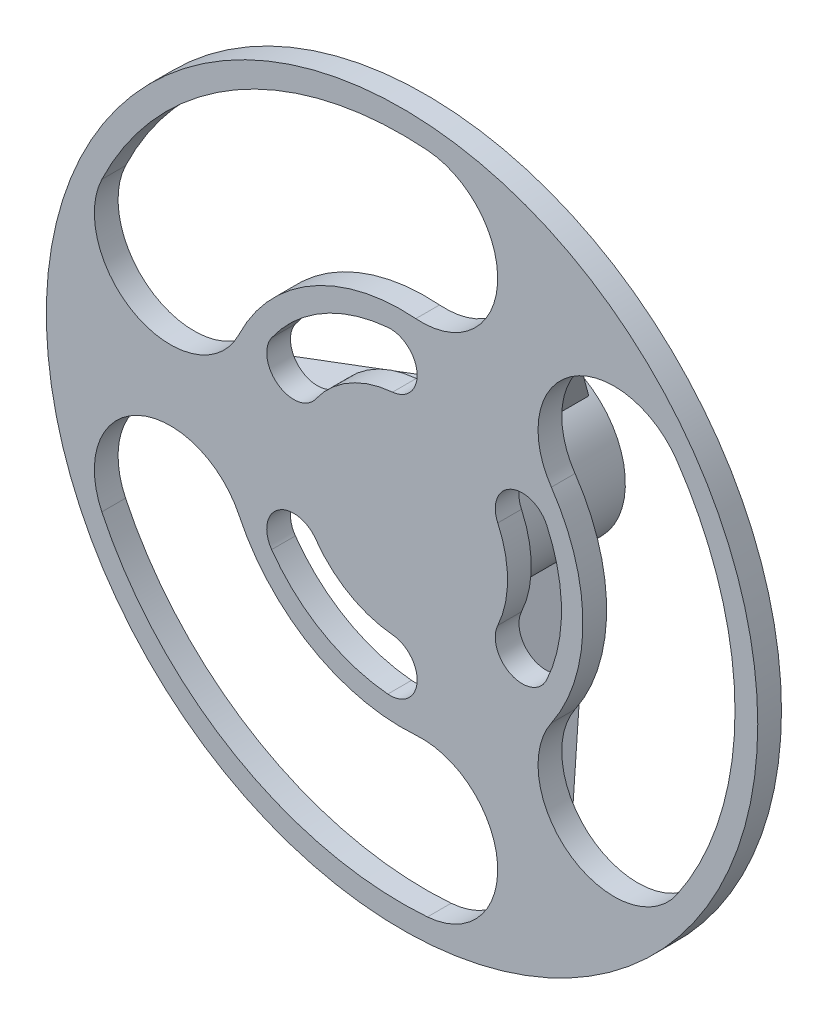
SolidWorks part; units mm, degrees
ref_plane "Plan de face" through (0, 0, 0) normal (0, 0, 1) x (1, 0, 0)
ref_plane "Plan de dessus" through (0, 0, 0) normal (0, 1, 0) x (1, 0, 0)
ref_plane "Plan de droite" through (0, 0, 0) normal (1, 0, 0) x (0, 0, -1)
sketch "Esquisse1" plane through (0, 0, 0) normal (0, 0, 1) x (1, 0, 0)
  circle A0 centre (0, 0) radius 45
  dimension "D1" = 90
extrude "Boss.-Extru.1" add sketch "Esquisse1" along normal blind 3
sketch "Esquisse2" plane through (0, 0, 0) normal (0, 0, -1) x (-1, 0, 0)
  circle A0 centre (0, 0) radius 7.25
  circle A1 centre (0, 0) radius 10.25
  dimension "D1" = 14.5
  dimension "D2" = 3
extrude "Boss.-Extru.2" add sketch "Esquisse2" along normal blind 15
sketch "Esquisse3" plane through (0, 0, 0) normal (0, 1, 0) x (1, 0, 0)
  line L0 (-8.8913, 15) -> (-33.9707, 0)
  line L1 (10.25, 15) -> (-10.25, 15) construction
  line L2 (45, 0) -> (-45, 0) construction
  line L3 (-33.9707, 0) -> (-8.8913, 0)
  line L4 (10.25, 0) -> (-10.25, 0) construction
  line L5 (-8.8913, 0) -> (-8.8913, 15)
extrude "Boss.-Extru.3" add sketch "Esquisse3" along normal mid plane 3
pattern_circular "Répétition circulaire1" count 3 over 360 about axis through (0, 0, 0) along (0, 0, 1) of "Boss.-Extru.3"
sketch "Esquisse4" plane through (0, 0, 0) normal (0, 0, -1) x (-1, 0, 0)
  line L0 (0, 0) -> (-16.9853, -29.4195) construction
  line L1 (-15.6863, -30.1695) -> (-18.2844, -28.6695) construction
  circle A0 centre (0, 0) radius 32.5 construction
  arc A1 (-2.4794, 32.4053) -> (29.3035, 14.0555) centre (0, 0) cw construction
  arc A2 (37.9768, 18.2156) -> (-3.2132, 41.9967) centre (0, 0) ccw
  arc A3 (20.6302, 9.8953) -> (-1.7455, 22.8139) centre (0, 0) ccw
  arc A4 (20.6302, 9.8953) -> (37.9768, 18.2156) centre (29.3035, 14.0555) ccw
  arc A5 (-3.2132, 41.9967) -> (-1.7455, 22.8139) centre (-2.4794, 32.4053) ccw
  circle A6 centre (0, 0) radius 16.7584 construction
  arc A7 (1.4985, 16.6912) -> (13.7058, 9.6434) centre (0, 0) cw construction
  arc A8 (16.4947, 11.6056) -> (1.8034, 20.0876) centre (0, 0) ccw
  arc A9 (10.9169, 7.6811) -> (1.1936, 13.2948) centre (0, 0) ccw
  arc A10 (10.9169, 7.6811) -> (16.4947, 11.6056) centre (13.7058, 9.6434) ccw
  arc A11 (1.8034, 20.0876) -> (1.1936, 13.2948) centre (1.4985, 16.6912) ccw
  point P6 (16.25, 28.1458)
  point P18 (8.3792, 14.5132)
  dimension "D1" = 65
extrude "Enlèv. mat.-Extru.1" cut sketch "Esquisse4" against normal blind 3
pattern_circular "Répétition circulaire2" count 3 over 360 about axis through (0, 0, 0) along (0, 0, 1) of "Enlèv. mat.-Extru.1"
